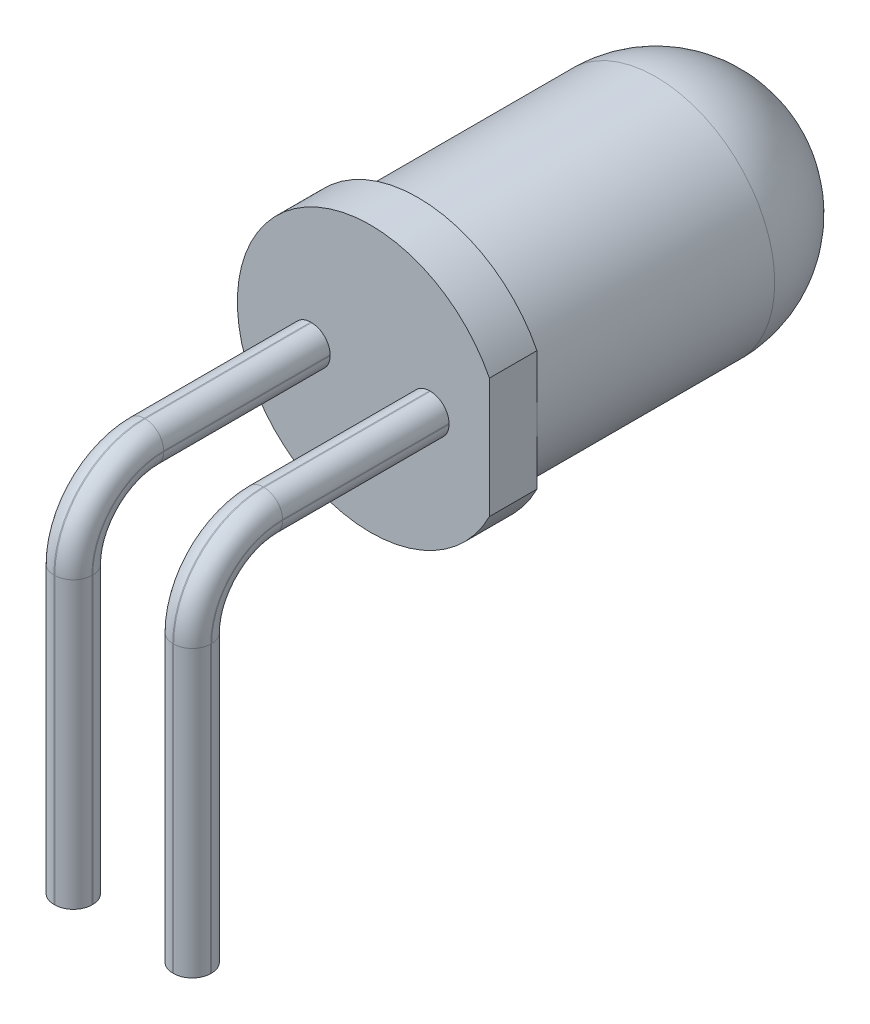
SolidWorks part; units mm, degrees
ref_plane "Face" through (0, 0, 0) normal (0, 0, 1) x (1, 0, 0)
ref_plane "Dessus" through (0, 0, 0) normal (0, 1, 0) x (1, 0, 0)
ref_plane "Droite" through (0, 0, 0) normal (1, 0, 0) x (0, 0, -1)
sketch "Esquisse1" plane through (0, 0, 0) normal (0, 0, 1) x (1, 0, 0)
  circle A0 centre (0, 0) radius 2.5
extrude "Base-Extrusion" add sketch "Esquisse1" along normal blind 8.5
sketch "Esquisse2" plane through (0, 0, 8.5) normal (0, 0, 1) x (1, 0, 0)
  line L0 (2.5, -2.4917) -> (2.5, 2.5621) construction
  line L1 (2.5, 1.261) -> (2.5, -1.261)
  arc A0 (2.5, 1.261) -> (2.5, -1.261) centre (0, 0) ccw
extrude "Boss.-Extru.1" add sketch "Esquisse2" against normal blind 1
fillet "Congé1" radius 2.5 1 edges at (2.5, 0, 0)
sketch "Esquisse4" plane through (0, 0, 0) normal (1, 0, 0) x (0, 0, -1)
  line L0 (1.383, 0) -> (-18.292, 0) construction
  line L1 (-8.5, 2.5234) -> (-8.5, -6.4179) construction
  line L2 (-12, 4.5057) -> (-12, -7.4301) construction
  line L3 (-13.5, 4.822) -> (-13.5, -7.8308) construction
  line L4 (-0.3251, -3) -> (-18.0389, -3) construction
  line L5 (-13.1, -1.5043) -> (-13.1, -7.5043)
  line L6 (-15.4873, -1.5) -> (-1.5, -1.5255) construction
  line L7 (-8.4545, -0.4) -> (-8.4545, 0.4)
  line L8 (-6, 4.1261) -> (-6, -7.641) construction
  line L9 (-13.1, -7.5043) -> (-13.9, -7.5043)
  line L10 (-8.4545, -0.4) -> (-12, -0.4)
  line L11 (-13.9, -7.5043) -> (-13.9, -1.5029)
  line L12 (-8.4545, 0.4) -> (-12, 0.4)
  arc A0 (-12, -0.4) -> (-13.1, -1.5043) centre (-12, -1.5) ccw
  arc A1 (-12, 0.4) -> (-13.9, -1.5029) centre (-12, -1.5) ccw
  dimension "D1" = 6
extrude "Boss.-Extru.2" add sketch "Esquisse4" along normal mid plane 3.3
sketch "Esquisse5" plane through (0, 0, 8.5) normal (0, 0, 1) x (1, 0, 0)
  line L0 (0, 2.2833) -> (0, -3.6189) construction
  line L1 (-0.85, 0.9378) -> (-0.85, -3.7624) construction
  line L2 (0.85, 0.8751) -> (0.85, -3.6906) construction
  line L4 (-0.85, 0.6239) -> (0.85, 0.6239)
  line L5 (-0.85, 0.6239) -> (-0.85, -17.2001)
  line L6 (-0.85, -17.2001) -> (0.85, -17.2001)
  line L7 (0.85, 0.6239) -> (0.85, -17.2001)
extrude "Enlèv. mat.-Extru.1" cut sketch "Esquisse5" along normal blind 10
fillet "Congé3" radius 0.39 24 edges at (-1.65, -0.7237, 12.7794) (-1.65, -0.4, 10.25) (-1.65, 0.4, 10.25) (-1.65, -0.1575, 13.3445) (-1.65, -4.5036, 13.9) (-1.65, -4.5043, 13.1) (1.65, -0.4, 10.25) (1.65, 0.4, 10.25) (1.65, -0.1575, 13.3445) (1.65, -4.5036, 13.9) (1.65, -4.5043, 13.1) (1.65, -0.7237, 12.7794) (0.85, -4.5043, 13.1) (-0.85, -4.5043, 13.1) (-0.85, -0.7237, 12.7794) (-0.85, -0.4, 10.25) (-0.85, 0.4, 10.25) (-0.85, -0.1575, 13.3445) (-0.85, -4.5036, 13.9) (0.85, -0.4, 10.25) (0.85, -0.7237, 12.7794) (0.85, -4.5036, 13.9) (0.85, -0.1575, 13.3445) (0.85, 0.4, 10.25)
